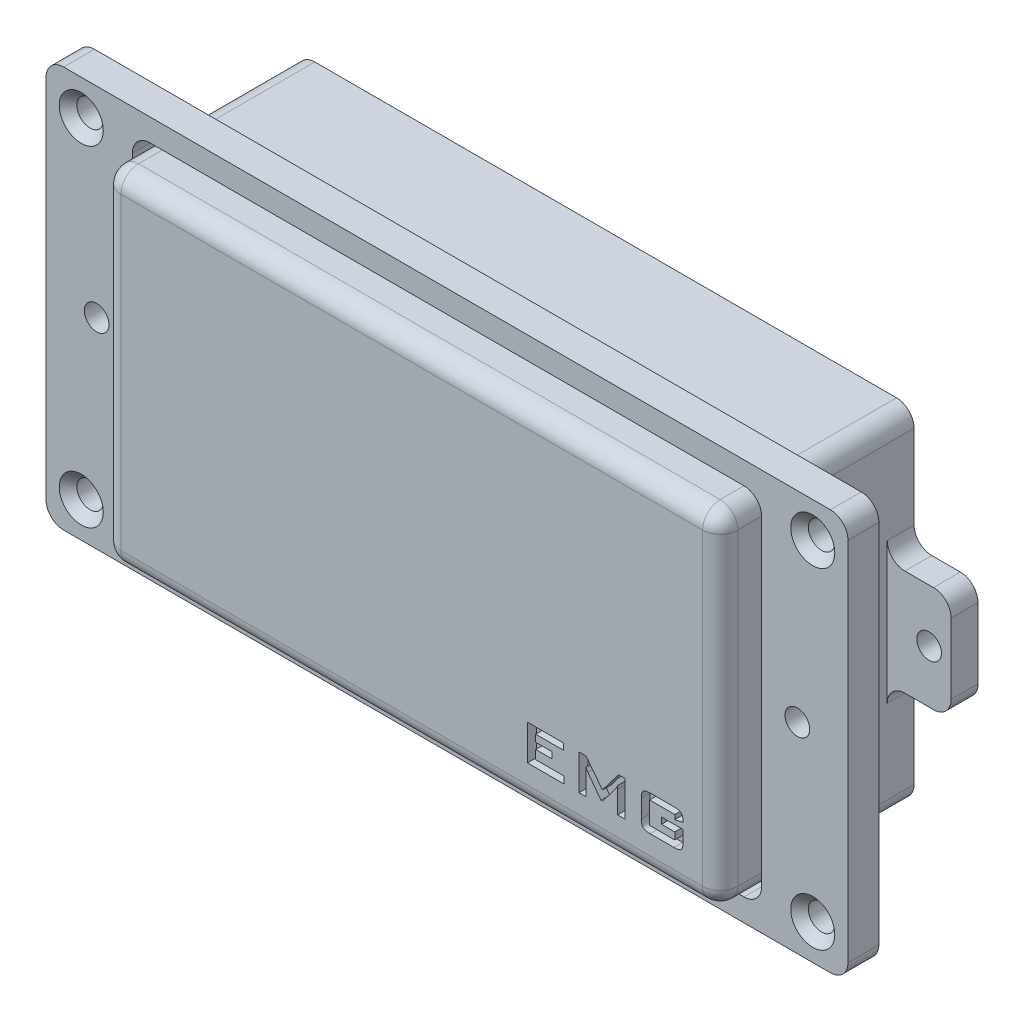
SolidWorks part; units mm, degrees
ref_plane "Спереди" through (0, 0, 0) normal (0, 0, 1) x (1, 0, 0)
ref_plane "Сверху" through (0, 0, 0) normal (0, 1, 0) x (1, 0, 0)
ref_plane "Справа" through (0, 0, 0) normal (1, 0, 0) x (0, 0, -1)
sketch "Эскиз1" plane through (0, 0, 0) normal (0, 0, 1) x (1, 0, 0)
  line L1 (-35, -19.5) -> (35, -19.5)
  line L2 (-35, -19.5) -> (-35, 19.5)
  line L3 (-35, 19.5) -> (35, 19.5)
  line L4 (35, -19.5) -> (35, 19.5)
  line L5 (-35, -19.5) -> (35, 19.5) construction
  line L6 (-35, 19.5) -> (35, -19.5) construction
  point P0 (0, 0)
  dimension "D1" = 70
  dimension "D2" = 39
extrude "Бобышка-Вытянуть1" add sketch "Эскиз1" against normal blind 22
sketch "Эскиз2" plane through (0, 0, -22) normal (0, 0, -1) x (-1, 0, 0)
  line L0 (0, 0) -> (0, 11.385)
  line L1 (42.25, -6) -> (-42.25, -6)
  line L2 (42.25, -6) -> (42.25, 6)
  line L3 (42.25, 6) -> (-42.25, 6)
  line L4 (-42.25, -6) -> (-42.25, 6)
  line L5 (42.25, -6) -> (-42.25, 6) construction
  line L6 (42.25, 6) -> (-42.25, -6) construction
  line L7 (42.25, 0) -> (39.75, 0)
  line L8 (-42.25, 0) -> (-39.75, 0)
  circle A0 centre (-39.75, 0) radius 1.4
  circle A1 centre (39.75, 0) radius 1.4
  point P0 (0, 0)
  dimension "D1" = 84.5
  dimension "D2" = 12
extrude "Бобышка-Вытянуть2" add sketch "Эскиз2" against normal blind 3.05
sketch "Эскиз3" plane through (0, 0, 0) normal (0, 0, 1) x (1, 0, 0)
  line L0 (35, 0) -> (35.7, 0)
  line L1 (-45.5, 22.75) -> (45.5, 22.75)
  line L2 (-45.5, 22.75) -> (-45.5, -22.75)
  line L3 (-45.5, -22.75) -> (45.5, -22.75)
  line L4 (45.5, 22.75) -> (45.5, -22.75)
  line L5 (-45.5, 22.75) -> (45.5, -22.75) construction
  line L6 (-45.5, -22.75) -> (45.5, 22.75) construction
  line L7 (35, -19.5) -> (35, 19.5) construction
  line L8 (0, -19.5) -> (0, -20.2)
  line L9 (-35, -19.5) -> (35, -19.5) construction
  line L11 (-35.7, 20.2) -> (35.7, 20.2)
  line L12 (-35.7, 20.2) -> (-35.7, -20.2)
  line L13 (-35.7, -20.2) -> (35.7, -20.2)
  line L14 (35.7, 20.2) -> (35.7, -20.2)
  line L15 (-35.7, 20.2) -> (35.7, -20.2) construction
  line L16 (-35.7, -20.2) -> (35.7, 20.2) construction
  point P0 (0, 0)
  point P14 (0, 0)
  dimension "D1" = 45.5
  dimension "D2" = 91
extrude "Бобышка-Вытянуть3" add sketch "Эскиз3" against normal blind 7.5 separate body contours L4 L1 L2 L3 L11 L14 L13 L12
sketch "Эскиз4" plane through (0, 0, 0) normal (0, 0, 1) x (1, 0, 0)
  line L1 (-45.5, 22.75) -> (45.5, 22.75)
  line L2 (-45.5, 22.75) -> (-45.5, -22.75)
  line L3 (-45.5, -22.75) -> (45.5, -22.75)
  line L4 (45.5, 22.75) -> (45.5, -22.75)
  line L5 (-45.5, 22.75) -> (45.5, -22.75) construction
  line L6 (-45.5, -22.75) -> (45.5, 22.75) construction
  line L7 (-35.7, 20.2) -> (35.7, 20.2)
  line L8 (-35.7, 20.2) -> (-35.7, -20.2)
  line L9 (-35.7, -20.2) -> (35.7, -20.2)
  line L10 (35.7, 20.2) -> (35.7, -20.2)
  line L11 (-35.7, 20.2) -> (35.7, -20.2) construction
  line L12 (-35.7, -20.2) -> (35.7, 20.2) construction
  point P0 (0, 0)
  point P7 (0, 0)
extrude "Вырез-Вытянуть1" cut sketch "Эскиз4" against normal blind 4
sketch "Эскиз5" plane through (0, 0, -22) normal (0, 0, -1) x (-1, 0, 0)
  circle A0 centre (-39.75, 0) radius 1.4
  circle A1 centre (39.75, 0) radius 1.4
extrude "Вырез-Вытянуть2" cut sketch "Эскиз5" against normal blind 64
sketch "Эскиз6" plane through (0, 0, -4) normal (0, 0, 1) x (1, 0, 0)
  line L0 (0, 0) -> (0, -5.9915)
  line L1 (-7.5078, 0) -> (7.439, 0)
  line L2 (45.5, -17.3557) -> (41.5, -17.3557)
  line L3 (45.5, -22.75) -> (45.5, 22.75) construction
  line L4 (41.5, -22.75) -> (41.5, -18.75)
  line L5 (-45.5, -22.75) -> (45.5, -22.75) construction
  circle A0 centre (41.5, -18.75) radius 1.5
  circle A1 centre (-41.5, -18.75) radius 1.5
  circle A2 centre (-41.5, 18.75) radius 1.5
  circle A3 centre (41.5, 18.75) radius 1.5
extrude "Вырез-Вытянуть3" cut sketch "Эскиз6" against normal blind 10
fillet "Скругление1" radius 2 8 edges at (-35, 19.5, -11) (35, 19.5, -11) (35, -19.5, -11) (-35, -19.5, -11) (0, 19.5, 0) (-35, 0, 0) (0, -19.5, 0) (35, 0, 0)
fillet "Скругление2" radius 2 4 edges at (45.5, 22.75, -5.75) (-45.5, 22.75, -5.75) (-45.5, -22.75, -5.75) (45.5, -22.75, -5.75)
fillet "Скругление3" radius 2 4 edges at (-35.7, 20.2, -5.75) (-35.7, -20.2, -5.75) (35.7, -20.2, -5.75) (35.7, 20.2, -5.75)
chamfer "Фаска1" distance 1 angle 45 4 edges at (-40, -18.75, -4) (-40, 18.75, -4) (43, 18.75, -4) (43, -18.75, -4)
sketch "Эскиз7" plane through (0, 0, 0) normal (0, 0, 1) x (1, 0, 0)
  text T0 "EMG" font "BankGothic Md BT" height 4
extrude "Вырез-Вытянуть4" cut sketch "Эскиз7" against normal blind 1
fillet "Скругление4" radius 2 8 edges at (-42.25, 6, -20.475) (-42.25, -6, -20.475) (42.25, -6, -20.475) (42.25, 6, -20.475)
sketch "Эскиз8" plane through (0, 0, -22) normal (0, 0, -1) x (-1, 0, 0)
  line L1 (-33, -17.5) -> (33, -17.5)
  line L2 (-33, -17.5) -> (-33, 17.5)
  line L3 (-33, 17.5) -> (33, 17.5)
  line L4 (33, -17.5) -> (33, 17.5)
  line L5 (-33, -17.5) -> (33, 17.5) construction
  line L6 (-33, 17.5) -> (33, -17.5) construction
  point P0 (0, 0)
extrude "Вырез-Вытянуть5" cut sketch "Эскиз8" against normal blind 1
sketch "Эскиз9" plane through (0, 0, -7.5) normal (0, 0, -1) x (-1, 0, 0)
  line L2 (35.1142, -19.6142) -> (-35.1142, -19.6142)
  line L4 (35.1142, -19.6142) -> (35.1142, 19.6142)
  line L5 (44, 21.25) -> (-44, 21.25)
  line L6 (44, 21.25) -> (44, -21.25)
  line L7 (44, -21.25) -> (-44, -21.25)
  line L8 (-44, 21.25) -> (-44, -21.25)
  line L9 (44, 21.25) -> (-44, -21.25) construction
  line L10 (44, -21.25) -> (-44, 21.25) construction
  line L11 (35.1142, 19.6142) -> (-35.1142, 19.6142)
  line L12 (-35.1142, -19.6142) -> (-35.1142, 19.6142)
  line L13 (35.1142, -19.6142) -> (-35.1142, 19.6142) construction
  line L14 (35.1142, 19.6142) -> (-35.1142, -19.6142) construction
  arc A0 (-33.7, 20.2) -> (-35.7, 18.2) centre (-33.7, 18.2) ccw construction
  point P0 (0, 0)
  point P8 (0, 0)
sketch "Эскиз10" plane through (0, 0, -4) normal (0, 0, 1) x (1, 0, 0)
extrude "Вырез-Вытянуть6" cut sketch "Эскиз9" against normal blind 1
sketch "Эскиз11" plane through (0, 0, -6.5) normal (0, 0, -1) x (-1, 0, 0)
  circle A0 centre (-41.5, 18.75) radius 2
  circle A1 centre (-41.5, -18.75) radius 2
  circle A2 centre (41.5, -18.75) radius 2
  circle A3 centre (41.5, 18.75) radius 2
  circle A4 centre (41.5, 18.75) radius 1.5
  circle A5 centre (41.5, -18.75) radius 1.5
  circle A6 centre (-41.5, -18.75) radius 1.5
  circle A7 centre (-41.5, 18.75) radius 1.5
extrude "Бобышка-Вытянуть4" add sketch "Эскиз11" along normal blind 1
